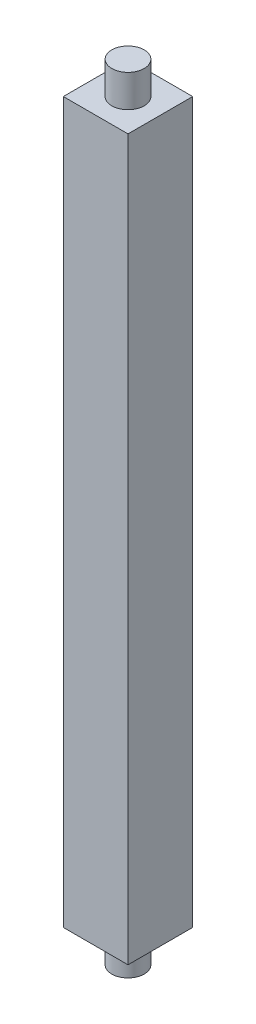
SolidWorks part; units mm, degrees
ref_plane "Front Plane" through (0, 0, 0) normal (0, 0, 1) x (1, 0, 0)
ref_plane "Top Plane" through (0, 0, 0) normal (0, 1, 0) x (1, 0, 0)
ref_plane "Right Plane" through (0, 0, 0) normal (1, 0, 0) x (0, 0, -1)
sketch "Sketch1" plane through (0, 0, 0) normal (0, 1, 0) x (1, 0, 0)
  line L1 (-2, -2) -> (2, -2)
  line L2 (-2, -2) -> (-2, 2)
  line L3 (-2, 2) -> (2, 2)
  line L4 (2, -2) -> (2, 2)
  line L5 (-2, -2) -> (2, 2) construction
  line L6 (-2, 2) -> (2, -2) construction
  point P0 (0, 0)
  dimension "D1" = 4
extrude "Boss-Extrude1" add sketch "Sketch1" along normal blind 44.5
sketch "Sketch2" plane through (0, 44.5, 0) normal (0, 1, 0) x (1, 0, 0)
  circle A0 centre (0, 0) radius 1
  dimension "D1" = 2
extrude "Boss-Extrude2" add sketch "Sketch2" along normal blind 2
sketch "Sketch3" plane through (0, 0, 0) normal (0, -1, 0) x (1, 0, 0)
  circle A0 centre (0, 0) radius 1
  dimension "D1" = 2
extrude "Boss-Extrude3" add sketch "Sketch3" along normal blind 2
